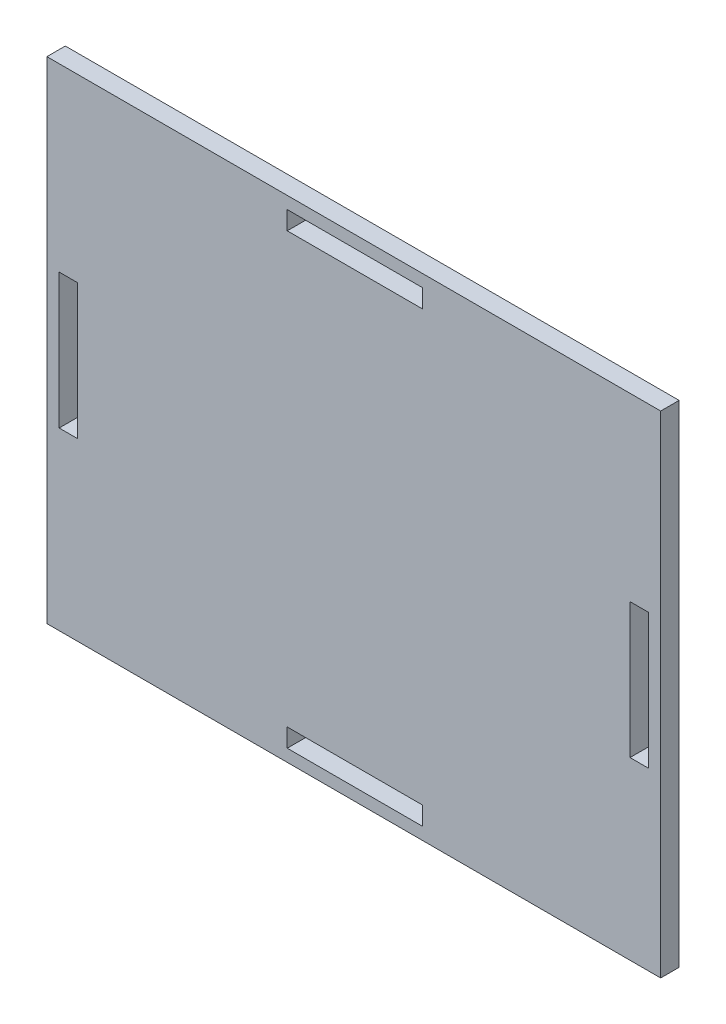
SolidWorks part; units mm, degrees
ref_plane "Front Plane" through (0, 0, 0) normal (0, 0, 1) x (1, 0, 0)
ref_plane "Top Plane" through (0, 0, 0) normal (0, 1, 0) x (1, 0, 0)
ref_plane "Right Plane" through (0, 0, 0) normal (1, 0, 0) x (0, 0, -1)
sketch "Sketch1" plane through (0, 0, 0) normal (0, 0, 1) x (1, 0, 0)
  line L0 (50, 80) -> (50, 0) construction
  line L1 (0, 0) -> (100, 0)
  line L2 (0, 0) -> (0, 80)
  line L3 (0, 80) -> (100, 80)
  line L4 (100, 0) -> (100, 80)
  line L5 (0, 40) -> (100, 40) construction
  line L6 (98, 28.6025) -> (95, 28.6025)
  line L7 (39.1572, 78) -> (61.1572, 78)
  line L8 (39.1572, 78) -> (39.1572, 75)
  line L9 (39.1572, 75) -> (61.1572, 75)
  line L10 (61.1572, 78) -> (61.1572, 75)
  line L11 (2, 50.6025) -> (5, 50.6025)
  line L12 (2, 50.6025) -> (2, 28.6025)
  line L13 (2, 28.6025) -> (5, 28.6025)
  line L14 (5, 50.6025) -> (5, 28.6025)
  line L15 (98, 50.6025) -> (95, 50.6025)
  line L16 (98, 50.6025) -> (98, 28.6025)
  line L17 (95, 50.6025) -> (95, 28.6025)
  line L18 (39.1572, 2) -> (39.1572, 5)
  line L19 (61.1572, 2) -> (61.1572, 5)
  line L20 (39.1572, 2) -> (61.1572, 2)
  line L21 (39.1572, 5) -> (61.1572, 5)
  point P17 (61.1572, 76.0072)
  point P18 (2, 50.6025)
  point P20 (3.3882, 30.6183)
  dimension "D1" = 100
  dimension "D2" = 80
  dimension "D3" = 22
  dimension "D4" = 3
  dimension "D5" = 2
  dimension "D6" = 2
  dimension "D7" = 3
  dimension "D8" = 22
extrude "Boss-Extrude1" add sketch "Sketch1" along normal blind 3
